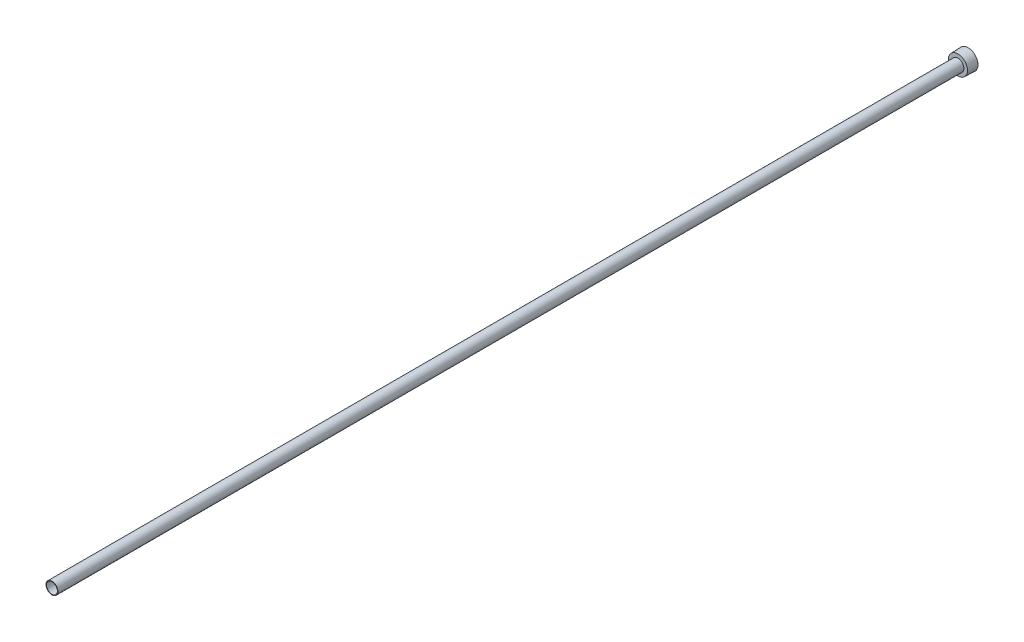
SolidWorks part; units mm, degrees
ref_plane "Front Plane" through (0, 0, 0) normal (0, 0, 1) x (1, 0, 0)
ref_plane "Top Plane" through (0, 0, 0) normal (0, 1, 0) x (1, 0, 0)
ref_plane "Right Plane" through (0, 0, 0) normal (1, 0, 0) x (0, 0, -1)
sketch "Sketch1" plane through (0, 0, 0) normal (1, 0, 0) x (0, 0, -1)
  line L0 (-278.0011, 0) -> (49721.9989, 0) construction
  line L1 (-1219.2, 0) -> (0, 0)
  line L6 (0, 0) -> (0, 13.2207)
  line L7 (0, 13.2207) -> (-13.4874, 12.7287)
  line L8 (-13.4874, 12.7287) -> (-13.4874, 7.9375)
  line L9 (-13.4874, 7.9375) -> (-1219.2, 7.9375)
  line L10 (-1219.2, 7.9375) -> (-1219.2, 0)
  dimension "D1" = 13.4874
  dimension "D2" = 26.4414
  dimension "D3" = 2.089
  dimension "D4" = 15.875
  dimension "D5" = 1219.2
revolve "Revolve1" add sketch "Sketch1" angle 360 about L0
sketch "Sketch2" plane through (0, 0, 1219.2) normal (0, 0, 1) x (1, 0, 0)
  circle A0 centre (0, 0) radius 7.2263
  dimension "D1" = 14.4526
extrude "Cut-Extrude1" cut sketch "Sketch2" against normal through all
sketch "Sketch3" plane through (0, 0, 0) normal (0, 0, -1) x (-1, 0, 0)
  line L0 (0, 14.5428) -> (0, -14.5428) construction
  line L1 (0, -10.9985) -> (9.525, -5.4993)
  line L2 (9.525, -5.4993) -> (9.525, 5.4993)
  line L3 (9.525, 5.4993) -> (0, 10.9985)
  line L4 (0, 10.9985) -> (-9.525, 5.4993)
  line L5 (-9.525, 5.4993) -> (-9.525, -5.4993)
  line L6 (-9.525, -5.4993) -> (0, -10.9985)
  circle A0 centre (0, 0) radius 9.525 construction
  dimension "D1" = 19.05
extrude "Cut-Extrude2" cut sketch "Sketch3" against normal blind 9.525
